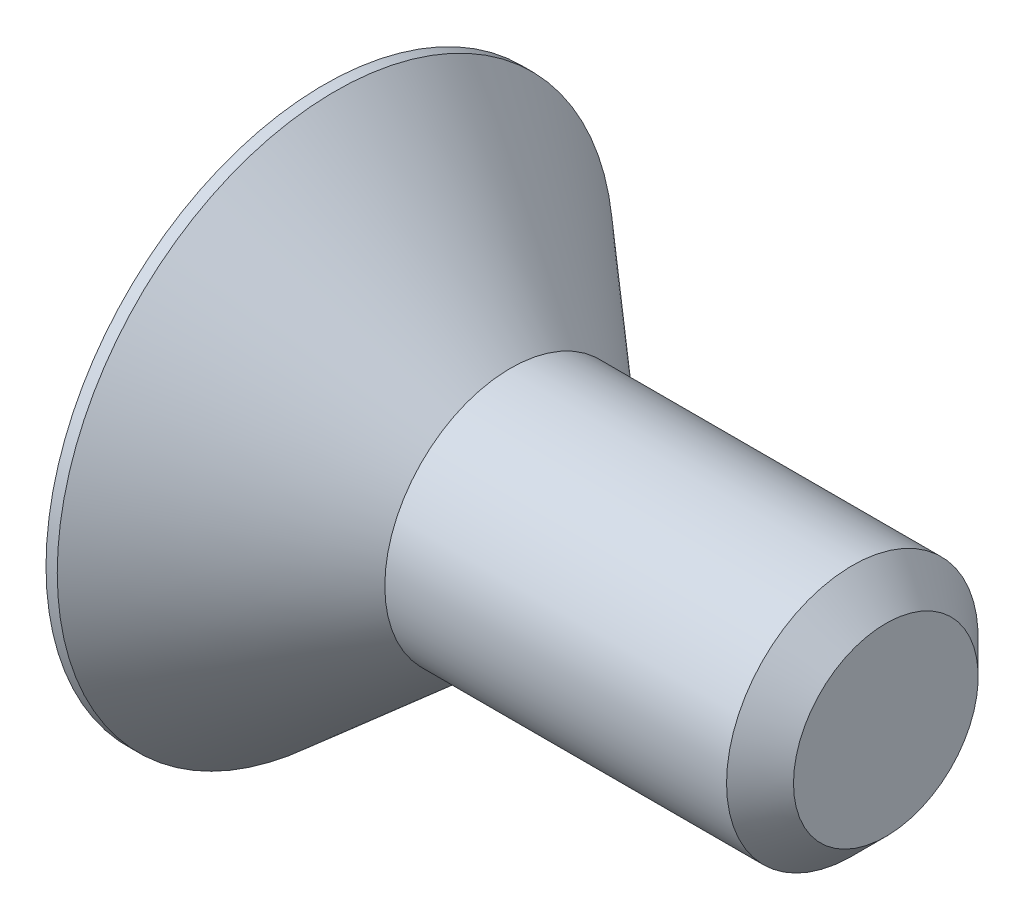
SolidWorks part; units mm, degrees
ref_plane "Plane1" through (0, 0, 0) normal (0, 0, 1) x (1, 0, 0)
ref_plane "Plane2" through (0, 0, 0) normal (0, 1, 0) x (1, 0, 0)
ref_plane "Plane3" through (0, 0, 0) normal (1, 0, 0) x (0, 0, -1)
sketch "BodySke" plane through (0, 0, 0) normal (0, 0, 1) x (1, 0, 0)
  line L0 (0, 0) -> (0, 3.1445)
  line L1 (0.127, 3.1445) -> (2.1081, 1.4224)
  line L2 (0, 3.1445) -> (0.127, 3.1445)
  line L3 (2.1081, 1.4224) -> (5.9715, 1.4224)
  line L4 (6.35, 1.0439) -> (6.35, 0)
  line L5 (6.35, 0) -> (0, 0)
  line L6 (0, 0) -> (127, 0) construction
  line L7 (0.127, -3.1445) -> (2.1081, -1.4224) construction
  line L8 (6.35, 1.0439) -> (5.9715, 1.4224)
  line L9 (0, -3.1445) -> (0.127, -3.1445) construction
  line L10 (6.35, -1.0439) -> (5.9715, -1.4224) construction
  line L11 (2.7431, 7.7724) -> (2.7431, -14.4526) construction
  line L12 (0, 19.05) -> (0, -3.175) construction
  dimension "D1" = 0.127
  dimension "Diameter" = 2.8448
  dimension "Length" = 6.35
  dimension "Body_ch_ang" = 45
  dimension "Head_dia" = 6.289
  dimension "Minor_dia" = 2.0879
  dimension "Head_ang" = 82
  dimension "Advance" = 0.635
  dimension "Thread_nom" = 6.35
revolve "BaseBody" add sketch "BodySke" angle 360 about L6
sketch "Sketch2" plane through (0, 0, 0) normal (0, 0, 1) x (1, 0, 0)
  line L0 (0, 0.7937) -> (1.397, 0.7937)
  line L1 (1.397, 0.7937) -> (1.8553, 0)
  line L2 (0, 0) -> (127, 0) construction
  line L3 (1.8553, 0) -> (0, 0)
  line L4 (0, 0) -> (0, 0.7937)
  line L5 (0, -0.7937) -> (1.397, -0.7937) construction
  line L6 (0, 0) -> (47.625, 0) construction
  line L8 (0, 3.1445) -> (0, -3.1445) construction
  dimension "D2" = 60
  dimension "PreBroach_depth" = 1.397
  dimension "PreBroach_dia" = 1.5875
revolve "PreBroach" cut sketch "Sketch2" angle 360 about L6
sketch "Sketch3" plane through (0, 0, 0) normal (-1, 0, 0) x (0, 0, 1)
  line L0 (-0.7938, -0.4583) -> (-0.7938, 0.4583)
  line L1 (-0.7938, 0.4583) -> (0, 0.9165)
  line L2 (0, 0.9165) -> (0.7937, 0.4583)
  line L3 (0.7937, 0.4583) -> (0.7937, -0.4583)
  line L4 (0.7937, -0.4583) -> (0, -0.9165)
  line L5 (0, -0.9165) -> (-0.7938, -0.4583)
  dimension "D1" = 0.7937
  dimension "D2" = 0.7937
  dimension "D3" = 1.5875
  dimension "Hex_size" = 1.5875
extrude "Hex" cut sketch "Sketch3" against normal blind 1.397
sketch "Sketch4" plane through (0, 0, 0) normal (-1, 0, 0) x (0, 0, 1)
  line L0 (0, 0) -> (0.9398, 0)
  line L1 (0, 0) -> (6.1484, 3.5498) construction
  line L2 (0, 0) -> (0.4699, 0.8139)
  line L3 (0.7832, 0.2175) -> (0.8962, 0.2828)
  line L4 (0.58, 0.5695) -> (0.693, 0.6348)
  arc A0 (0.7832, 0.2175) -> (0.58, 0.5695) centre (0, 0) ccw
  arc A1 (0.9398, 0) -> (0.8962, 0.2828) centre (0, 0) ccw
  arc A2 (0.4699, 0.8139) -> (0.693, 0.6348) centre (0, 0) cw
  dimension "D1" = 30
  dimension "Spline_n_dim" = 1.6256
  dimension "Spline_m_dim" = 1.8796
  dimension "D2" = 60
  dimension "D3" = 0.2032
  dimension "Spline_p_dim" = 0.4064
extrude "Spline" [suppressed] cut sketch "Sketch4" against normal blind 1.397
pattern_circular "CirPattern1" [suppressed] count 6 every 60 about axis through (0, 0, 0) along (1, 0, 0)
sketch "ThdSchSke" plane through (0, 0, 0) normal (0, 0, 1) x (1, 0, 0)
  line L0 (2.6161, -1.0439) -> (2.3511, -1.4224)
  line L1 (2.6161, -1.0439) -> (2.8811, -1.4224)
  line L2 (2.8811, -1.4224) -> (2.8811, -1.778)
  line L3 (-3.175, 0) -> (5.1513, 0) construction
  line L4 (0, 3.1445) -> (0, -3.1445) construction
  line L5 (2.8811, -1.778) -> (2.3511, -1.778)
  line L6 (2.3511, -1.778) -> (2.3511, -1.4224)
  dimension "Thread_minor" = 2.0879
  dimension "Diameter" = 2.8448
  dimension "Start" = 2.6161
  dimension "SideAngle" = 55
  dimension "VeeAngle" = 70
  dimension "Overcut" = 3.556
revolve "ThreadSchematic" [suppressed] cut sketch "ThdSchSke" angle 360 about L3
pattern_linear "ThdSchPat" [suppressed]
equation "\"D3@Sketch4\" = \"Spline_p_dim@Sketch4\" / 2"
equation "\"Thread_minor@ThreadCosmetic\"  =  \"Minor_dia@BodySke\""
equation "\"D2@CirPattern1\" = 360 / \"Num_teeth@CirPattern1\""
equation "\"D1@Sketch3\" = \"Hex_size@Sketch3\" / 2"
equation "\"D2@Sketch3\" = \"D1@Sketch3\""
equation "\"D3@Sketch3\" = \"Hex_size@Sketch3\""
equation "\"Thread_length@ThreadCosmetic\" = ((sgn( (\"Length@BodySke\" - \"Advance@BodySke\" - ( ( ( \"Head_dia@BodySke\" - \"Diameter@BodySke\" ) * 0.5 ) / tan( \"Head_ang@BodySke\" * 0.008726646 ) ) ) - \"Thread_nom@Body"
equation "\"Thread_minor@ThdSchSke\" = \"Minor_dia@BodySke\""
equation "\"Diameter@ThdSchSke\" = \"Diameter@BodySke\""
equation "\"Overcut@ThdSchSke\" = \"Diameter@BodySke\" * 1.25"
equation "\"Start@ThdSchSke\" = 0.000001 + \"Length@BodySke\" - \"Thread_length@ThreadCosmetic\"  '---Countersunk---"
equation "\"Num_threads@ThdSchPat\" = int( \"Thread_length@ThreadCosmetic\" / \"Advance@BodySke\" + 0.999 )  + 1"
equation "\"Advance@ThdSchPat\" = \"Thread_length@ThreadCosmetic\" /  (\"Num_threads@ThdSchPat\" - 1) 'relax it"
equation "\"Num_threads@ThdSchPat\" = \"Num_threads@ThdSchPat\" - sgn( \"Num_threads@ThdSchPat\" - 1) '---chamfered tips only---"
